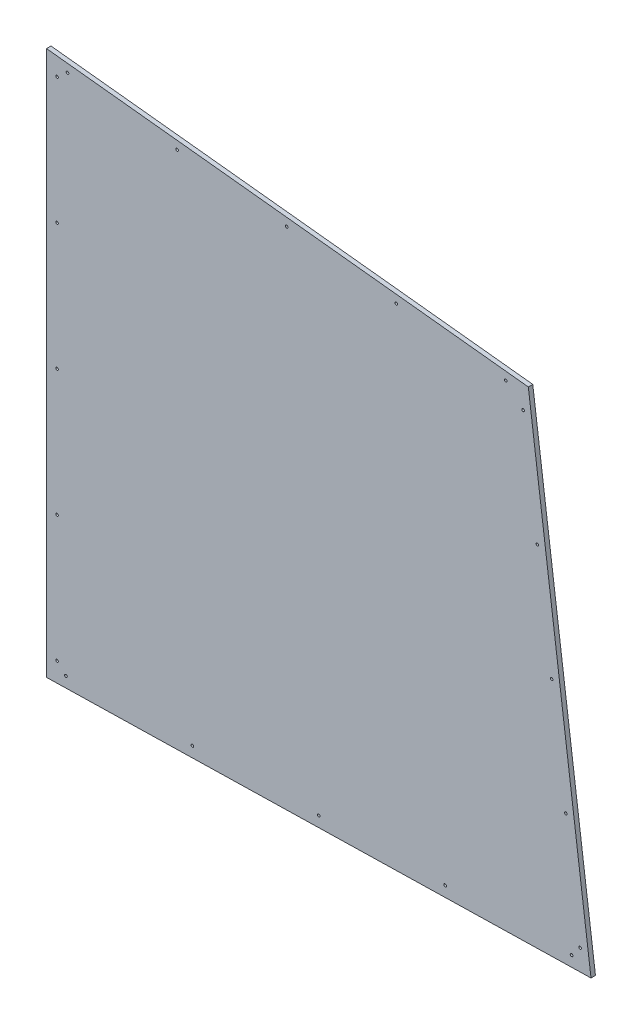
SolidWorks part; units mm, degrees
ref_plane "Front Plane" through (0, 0, 0) normal (0, 0, 1) x (1, 0, 0)
ref_plane "Top Plane" through (0, 0, 0) normal (0, 1, 0) x (1, 0, 0)
ref_plane "Right Plane" through (0, 0, 0) normal (1, 0, 0) x (0, 0, -1)
sketch "Sketch1" plane through (0, 0, 0) normal (0, 0, 1) x (1, 0, 0)
  line L1 (-175.5019, -179.384) -> (891.0428, -156.0475) construction
  line L2 (-175.5019, -179.384) -> (-175.5019, 887.416)
  line L3 (-175.5019, -179.384) -> (891.0428, -156.0475)
  line L4 (891.0428, -156.0475) -> (768.2656, 785.2596) construction
  line L5 (-175.5019, 887.416) -> (768.2656, 785.2596) construction
  line L6 (891.0428, -156.0475) -> (768.2656, 785.2596)
  line L7 (-175.5019, 887.416) -> (768.2656, 785.2596)
  line L9 (-175.5019, -174.9698) -> (-175.5019, 887.416) construction
extrude "Boss-Extrude1" add sketch "Sketch1" along normal blind 8.7312
sketch "Positioning_Sketch" [suppressed] plane through (0, 0, 8.7312) normal (0, 0, -1) x (-1, 0, 0)
  line L0 (175.5019, -179.384) -> (-768.2656, 785.2596)
sketch "Sketch2" plane through (0, 0, 0) normal (0, 0, -1) x (-1, 0, 0)
  line L1 (-514.7481, 461.9281) -> (-519.1934, 55.5524) construction
  line L2 (-514.7481, 461.9281) -> (-519.1934, 55.5524)
  line L3 (-50.0161, -13.0837) -> (-456.3918, -8.6384) construction
  line L4 (-50.0161, -13.0837) -> (-456.3918, -8.6384)
  line L5 (18.62, 456.0936) -> (14.1747, 49.7179) construction
  line L6 (18.62, 456.0936) -> (14.1747, 49.7179)
  line L7 (-44.1816, 520.2844) -> (-450.5573, 524.7297) construction
  line L8 (-44.1816, 520.2844) -> (-450.5573, 524.7297)
  arc A1 (-519.1934, 55.5524) -> (-456.3918, -8.6384) centre (-455.6972, 54.8578) ccw construction
  arc A2 (-519.1934, 55.5524) -> (-456.3918, -8.6384) centre (-455.6972, 54.8578) ccw
  arc A3 (-50.0161, -13.0837) -> (14.1747, 49.7179) centre (-49.3215, 50.4125) ccw construction
  arc A4 (-50.0161, -13.0837) -> (14.1747, 49.7179) centre (-49.3215, 50.4125) ccw
  arc A5 (18.62, 456.0936) -> (-44.1816, 520.2844) centre (-44.8762, 456.7882) ccw construction
  arc A6 (18.62, 456.0936) -> (-44.1816, 520.2844) centre (-44.8762, 456.7882) ccw
  arc A7 (-450.5573, 524.7297) -> (-514.7481, 461.9281) centre (-451.2519, 461.2335) ccw construction
  arc A8 (-450.5573, 524.7297) -> (-514.7481, 461.9281) centre (-451.2519, 461.2335) ccw
  circle A9 centre (-514.7039, -2.8718) radius 2.7781 construction
  circle A10 centre (-514.7039, -2.8718) radius 2.7781
  circle A11 centre (-393.104, -28.3818) radius 2.7781 construction
  circle A12 centre (-393.104, -28.3818) radius 2.7781
  circle A13 centre (-253.4123, -29.9099) radius 2.7781 construction
  circle A14 centre (-253.4123, -29.9099) radius 2.7781
  circle A15 centre (-113.7207, -31.438) radius 2.7781 construction
  circle A16 centre (-113.7207, -31.438) radius 2.7781
  circle A17 centre (8.4082, -8.5941) radius 2.7781 construction
  circle A18 centre (8.4082, -8.5941) radius 2.7781
  circle A19 centre (33.9181, 113.0058) radius 2.7781 construction
  circle A20 centre (33.9181, 113.0058) radius 2.7781
  circle A21 centre (35.4462, 252.6974) radius 2.7781 construction
  circle A22 centre (35.4462, 252.6974) radius 2.7781
  circle A23 centre (36.9743, 392.3891) radius 2.7781 construction
  circle A24 centre (36.9743, 392.3891) radius 2.7781
  circle A25 centre (14.1304, 514.5179) radius 2.7781 construction
  circle A26 centre (14.1304, 514.5179) radius 2.7781
  circle A27 centre (-107.4695, 540.0278) radius 2.7781 construction
  circle A28 centre (-107.4695, 540.0278) radius 2.7781
  circle A29 centre (-247.1611, 541.5559) radius 2.7781 construction
  circle A30 centre (-247.1611, 541.5559) radius 2.7781
  circle A31 centre (-386.8527, 543.084) radius 2.7781 construction
  circle A32 centre (-386.8527, 543.084) radius 2.7781
  circle A33 centre (-508.9816, 520.2402) radius 2.7781 construction
  circle A34 centre (-508.9816, 520.2402) radius 2.7781
  circle A35 centre (-534.4915, 398.6403) radius 2.7781 construction
  circle A36 centre (-534.4915, 398.6403) radius 2.7781
  circle A37 centre (-536.0196, 258.9486) radius 2.7781 construction
  circle A38 centre (-536.0196, 258.9486) radius 2.7781
  circle A39 centre (-537.5477, 119.257) radius 2.7781 construction
  circle A40 centre (-537.5477, 119.257) radius 2.7781
extrude "Cut-Extrude1" [suppressed] cut sketch "Sketch2" against normal through all
sketch "Sketch3" plane through (0, 0, 8.7312) normal (0, 0, 1) x (1, 0, 0)
  line L0 (-154.8644, -178.9324) -> (-154.8644, -140.8324) construction
  line L1 (-154.8644, -140.8324) -> (-154.8644, 106.8176) construction
  line L2 (-175.5019, 887.416) -> (-175.5019, -179.384) construction
  line L3 (-175.5019, -179.384) -> (891.0428, -156.0475) construction
  line L4 (-154.8644, 106.8176) -> (-154.8644, 354.4676) construction
  line L5 (-154.8644, 354.4676) -> (-154.8644, 602.1176) construction
  line L6 (-154.8644, 602.1176) -> (-154.8644, 849.7676) construction
  line L7 (-154.8644, 849.7676) -> (-154.8644, 885.1821) construction
  line L8 (768.2656, 785.2596) -> (-175.5019, 887.416) construction
  line L9 (-175.5019, -158.7416) -> (-137.411, -157.9081) construction
  line L10 (-137.411, -157.9081) -> (110.1797, -152.4907) construction
  line L11 (110.1797, -152.4907) -> (357.7704, -147.0733) construction
  line L12 (357.7704, -147.0733) -> (605.3612, -141.6559) construction
  line L13 (605.3612, -141.6559) -> (852.9519, -136.2385) construction
  line L14 (852.9519, -136.2385) -> (888.358, -135.4638) construction
  line L15 (891.0428, -156.0475) -> (768.2656, 785.2596) construction
  line L16 (-175.5019, 871.4483) -> (-134.4666, 867.0065) construction
  line L17 (-134.4666, 867.0065) -> (80.1796, 843.7725) construction
  line L18 (80.1796, 843.7725) -> (294.8258, 820.5385) construction
  line L19 (294.8258, 820.5385) -> (509.472, 797.3045) construction
  line L20 (509.472, 797.3045) -> (724.1182, 774.0705) construction
  line L21 (724.1182, 774.0705) -> (770.3782, 769.0632) construction
  line L22 (875.0789, -156.3968) -> (869.7405, -115.4685) construction
  line L23 (869.7405, -115.4685) -> (841.8166, 98.6181) construction
  line L24 (841.8166, 98.6181) -> (813.8927, 312.7047) construction
  line L25 (813.8927, 312.7047) -> (785.9689, 526.7913) construction
  line L26 (785.9689, 526.7913) -> (758.045, 740.8779) construction
  line L27 (758.045, 740.8779) -> (752.0269, 787.0173) construction
  circle A0 centre (-134.4666, 867.0065) radius 2.5794
  circle A1 centre (-154.8644, 849.7676) radius 2.5794
  circle A2 centre (80.1796, 843.7725) radius 2.5794
  circle A3 centre (294.8258, 820.5385) radius 2.5794
  circle A4 centre (509.472, 797.3045) radius 2.5794
  circle A5 centre (724.1182, 774.0705) radius 2.5794
  circle A6 centre (758.045, 740.8779) radius 2.5794
  circle A7 centre (785.9689, 526.7913) radius 2.5794
  circle A8 centre (813.8927, 312.7047) radius 2.5794
  circle A9 centre (841.8166, 98.6181) radius 2.5794
  circle A10 centre (869.7405, -115.4685) radius 2.5794
  circle A11 centre (852.9519, -136.2385) radius 2.5794
  circle A12 centre (605.3612, -141.6559) radius 2.5794
  circle A13 centre (357.7704, -147.0733) radius 2.5794
  circle A14 centre (110.1797, -152.4907) radius 2.5794
  circle A15 centre (-137.411, -157.9081) radius 2.5794
  circle A16 centre (-154.8644, -140.8324) radius 2.5794
  circle A17 centre (-154.8644, 106.8176) radius 2.5794
  circle A18 centre (-154.8644, 354.4676) radius 2.5794
  circle A19 centre (-154.8644, 602.1176) radius 2.5794
  dimension "D10" = 5.1587
  dimension "D1" = 20.6375
  dimension "D2" = 38.1
  dimension "D3" = 247.65
  dimension "D4" = 20.6375
  dimension "D5" = 38.1
  dimension "D6" = 15.875
  dimension "D7" = 41.275
  dimension "D8" = 215.9
  dimension "D9" = 15.875
  dimension "D11" = 35.4146
  dimension "D12" = 35.4146
extrude "Cut-Extrude2" cut sketch "Sketch3" against normal through all
sketch "Sketch4" [suppressed] plane through (0, 0, 8.7312) normal (0, 0, 1) x (1, 0, 0)
  line L0 (-175.5019, -179.384) -> (768.2656, 785.2596) construction
  line L1 (-51.1611, -52.2927) -> (-59.496, 709.6617) construction
  line L2 (-51.1611, -52.2927) -> (710.7934, -43.9578) construction
  line L3 (-59.496, 709.6617) -> (702.4584, 717.9967) construction
  line L4 (702.4584, 717.9967) -> (710.7934, -43.9578) construction
  line L5 (687.899, 348.6373) -> (333.5059, 695.3609)
  line L6 (-51.8556, 11.2035) -> (-58.8014, 646.1655)
  line L7 (4.0002, 710.3563) -> (288.4039, 713.4673)
  line L8 (710.0988, 19.5384) -> (706.9877, 303.9421)
  line L9 (12.3351, -51.5982) -> (647.2972, -44.6523)
  line L10 (-71.0975, 580.1458) -> (-70.8718, 559.5095) construction
  line L11 (-70.9847, 569.8276) -> (-99.5597, 569.5151) construction
  line L12 (-70.8718, 559.5095) -> (-65.8187, 97.5747) construction
  line L13 (-65.8187, 97.5747) -> (-65.593, 76.9384) construction
  line L14 (-65.7059, 87.2565) -> (-94.2809, 86.9439) construction
  arc A0 (12.3351, -51.5982) -> (-51.8556, 11.2035) centre (11.6406, 11.8981) cw
  arc A1 (-58.8014, 646.1655) -> (4.0002, 710.3563) centre (4.6948, 646.8601) cw
  arc A2 (710.0988, 19.5384) -> (647.2972, -44.6523) centre (646.6026, 18.8439) cw
  arc A3 (706.9877, 303.9421) -> (687.899, 348.6373) centre (643.4915, 303.2476) ccw
  arc A4 (288.4039, 713.4673) -> (333.5059, 695.3609) centre (289.0985, 649.9711) cw
  circle A5 centre (-99.5597, 569.5151) radius 2.3813
  circle A6 centre (-65.593, 76.9384) radius 2.3813
  circle A7 centre (-94.2809, 86.9439) radius 2.3813
  circle A8 centre (-65.8187, 97.5747) radius 2.3813
  circle A9 centre (-71.0975, 580.1458) radius 2.3813
  circle A10 centre (-70.8718, 559.5095) radius 2.3813
  circle A11 centre (691.9468, 389.0951) radius 2.3812
  circle A12 centre (637.4791, 442.3841) radius 2.3812
  circle A13 centre (583.0114, 495.673) radius 2.3812
  circle A14 centre (691.9468, 389.0951) radius 1.5875 construction
  circle A15 centre (637.4791, 442.3841) radius 1.5875 construction
  circle A16 centre (583.0114, 495.673) radius 1.5875 construction
  circle A17 centre (772.4145, 272.1185) radius 2.3812
  circle A18 centre (718.4681, 271.5284) radius 2.3812
  circle A19 centre (718.4681, 271.5284) radius 3.175 construction
  circle A20 centre (772.1367, 297.517) radius 2.3812
  circle A21 centre (718.1903, 296.9269) radius 2.3812
  circle A22 centre (718.1903, 296.9269) radius 3.175 construction
  circle A23 centre (772.1367, 297.517) radius 3.175 construction
  circle A24 centre (772.4145, 272.1185) radius 3.175 construction
  point P10 (510.7024, 521.9991)
  dimension "D5" = 63.5
  dimension "D10" = 4.7625
  dimension "D6" = 4.7625
  dimension "D1" = 45
  dimension "D2" = 177.8
  dimension "D3" = 762
  dimension "D4" = 368.3
  dimension "D7" = 20.6375
  dimension "D8" = 139.7
  dimension "D9" = 139.7
  dimension "D11" = 28.575
  dimension "D12" = 13.0175
extrude "Cut-Extrude3" [suppressed] cut sketch "Sketch4" against normal through all
sketch "Sketch5" [suppressed] plane through (0, 0, 8.7312) normal (0, 0, 1) x (1, 0, 0)
  circle A0 centre (770.2986, 351.4913) radius 3.9687
  circle A1 centre (552.4278, 564.6471) radius 3.9687
  circle A2 centre (334.5571, 777.8029) radius 3.9688
  circle A3 centre (770.2986, 351.4913) radius 3.9687 construction
  circle A4 centre (552.4278, 564.6471) radius 3.9688 construction
  circle A5 centre (334.5571, 777.8029) radius 3.9687 construction
  dimension "D1" = 7.9375
extrude "Cut-Extrude4" [suppressed] cut sketch "Sketch5" against normal through all
